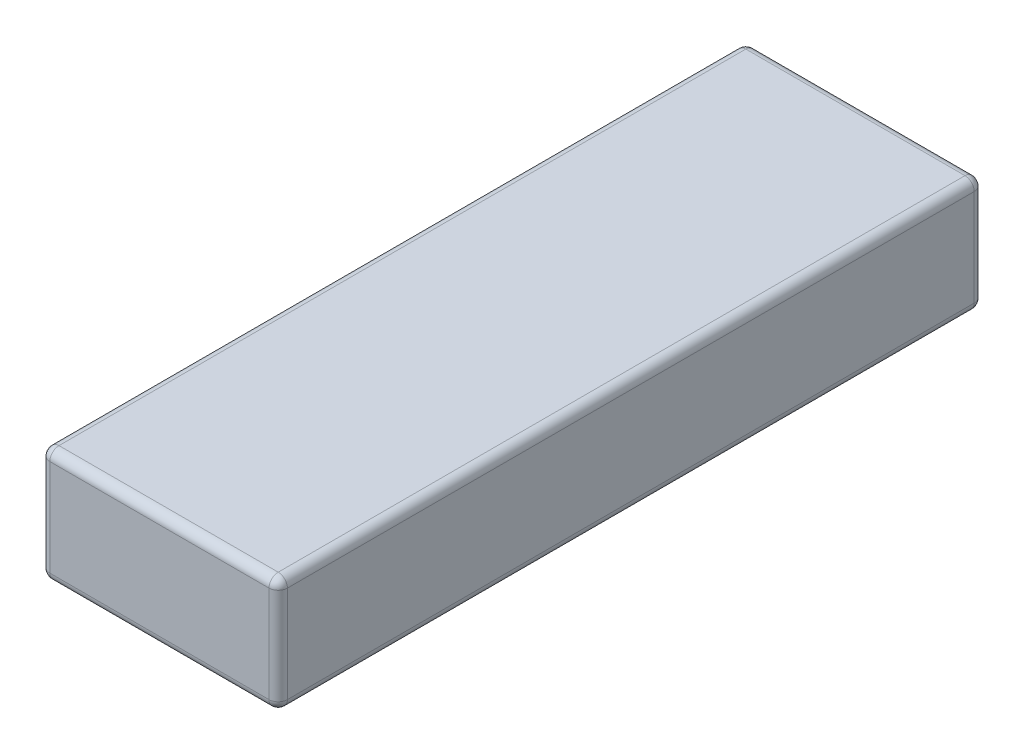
SolidWorks part; units mm, degrees
ref_plane "Front Plane" through (0, 0, 0) normal (0, 0, 1) x (1, 0, 0)
ref_plane "Top Plane" through (0, 0, 0) normal (0, 1, 0) x (1, 0, 0)
ref_plane "Right Plane" through (0, 0, 0) normal (1, 0, 0) x (0, 0, -1)
sketch "Sketch1" plane through (0, 0, 0) normal (0, 0, 1) x (1, 0, 0)
  line L1 (-38.75, 18.75) -> (38.75, 18.75)
  line L2 (-38.75, 18.75) -> (-38.75, -18.75)
  line L3 (-38.75, -18.75) -> (38.75, -18.75)
  line L4 (38.75, 18.75) -> (38.75, -18.75)
  line L5 (-38.75, 18.75) -> (38.75, -18.75) construction
  line L6 (-38.75, -18.75) -> (38.75, 18.75) construction
  point P0 (0, 0)
  dimension "D1" = 37.5
  dimension "D2" = 77.5
extrude "Boss-Extrude1" add sketch "Sketch1" along normal mid plane 230
fillet "Fillet1" radius 3 12 edges at (-38.75, 0, -115) (-38.75, -18.75, 0) (0, -18.75, -115) (0, -18.75, 115) (-38.75, 0, 115) (38.75, -18.75, 0) (38.75, 0, 115) (38.75, 0, -115) (38.75, 18.75, 0) (0, 18.75, 115) (-38.75, 18.75, 0) (0, 18.75, -115)
